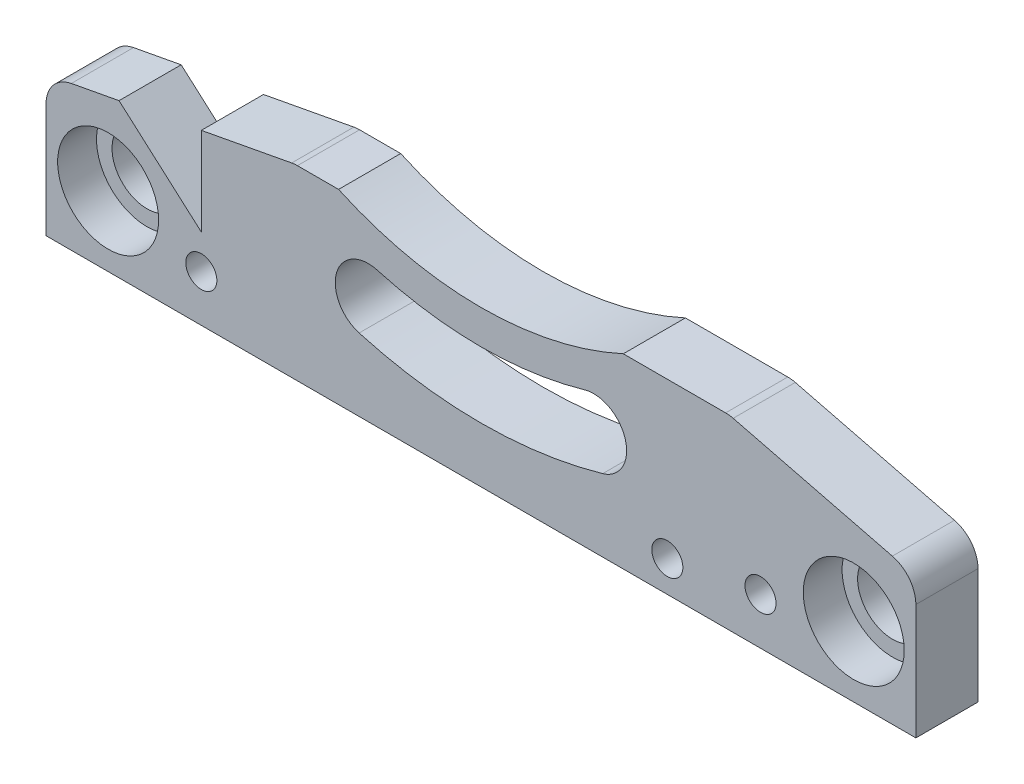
SolidWorks part; units mm, degrees
ref_plane "Front" through (0, 0, 0) normal (0, 0, 1) x (1, 0, 0)
ref_plane "Top" through (0, 0, 0) normal (0, 1, 0) x (1, 0, 0)
ref_plane "Right" through (0, 0, 0) normal (1, 0, 0) x (0, 0, -1)
sketch "Sketch1" plane through (0, 0, 0) normal (0, 0, 1) x (1, 0, 0)
  line L0 (0, 67.1585) -> (0, -46.3958) construction
  line L1 (44.45, 0) -> (-44.45, 0)
  line L2 (-44.45, 0) -> (-44.45, 19.05)
  line L3 (44.45, 0) -> (44.45, 19.05)
  line L4 (-44.45, 19.05) -> (44.45, 19.05)
  point P6 (0, 0)
  point P9 (0, 19.05)
  dimension "D1" = 88.9
  dimension "D2" = 19.05
extrude "Base-Extrude" add sketch "Sketch1" along normal blind 6.35
sketch "Sketch2" plane through (0, 0, 6.35) normal (0, 0, 1) x (1, 0, 0)
  line L0 (44.45, 14.2875) -> (25.4, 19.05)
  line L1 (44.45, 0) -> (44.45, 19.05) construction
  line L2 (-44.45, 19.05) -> (44.45, 19.05) construction
  line L3 (44.45, 0) -> (-44.45, 0) construction
  line L4 (25.4, 19.05) -> (44.45, 19.05)
  line L5 (44.45, 14.2875) -> (44.45, 19.05)
  dimension "D1" = 14.2875
  dimension "D2" = 19.05
extrude "Cut-Extrude1" cut sketch "Sketch2" against normal through all
sketch "Sketch3" plane through (0, 0, 6.35) normal (0, 0, 1) x (1, 0, 0)
  line L0 (-44.45, 19.05) -> (25.4, 19.05) construction
  line L1 (0, -50) -> (0, 50) construction
  line L2 (44.45, 0) -> (-44.45, 0) construction
  arc A0 (-14.5497, 19.05) -> (14.5497, 19.05) centre (0, 50.8) ccw
  dimension "D1" = 34.925
  dimension "D2" = 50.8
extrude "Cut-Extrude2" cut sketch "Sketch3" against normal through all
sketch "Sketch4" plane through (0, 0, 6.35) normal (0, 0, 1) x (1, 0, 0)
  line L0 (-44.45, 14.2875) -> (-19.05, 19.05)
  line L1 (-44.45, 0) -> (-44.45, 19.05) construction
  line L2 (-44.45, 19.05) -> (-14.5497, 19.05) construction
  dimension "D1" = 25.4
extrude "Cut-Extrude3" cut sketch "Sketch4" against normal through all
sketch "Sketch5" plane through (0, 0, 6.35) normal (0, 0, 1) x (1, 0, 0)
  line L0 (-36.9844, 15.6873) -> (-28.575, 8.2623)
  line L1 (-44.45, 14.2875) -> (-19.05, 19.05) construction
  line L2 (-19.05, 19.05) -> (-30.473, 6.1126) construction
  line L3 (-28.575, 8.2623) -> (-28.575, 17.2641)
  line L4 (-36.9844, 15.6873) -> (-28.575, 17.2641)
  line L5 (0, 58.217) -> (0, 5.9282) construction
  arc A0 (-14.5497, 19.05) -> (14.5497, 19.05) centre (0, 50.8) ccw construction
  point P11 (0, 50.8)
  dimension "D1" = 90
  dimension "D2" = 50.8
  dimension "D3" = 28.575
extrude "Cut-Extrude4" cut sketch "Sketch5" against normal through all
sketch "Sketch6" plane through (0, 0, 6.35) normal (0, 0, 1) x (1, 0, 0)
  line L0 (0, 50.8) -> (-14.5667, 0) construction
  line L1 (44.45, 0) -> (-44.45, 0) construction
  line L2 (0, 50.8) -> (14.5667, 0) construction
  line L3 (0, 65.7216) -> (0, 18.1985) construction
  arc A0 (-10.5871, 13.8784) -> (10.5871, 13.8784) centre (0, 50.8) ccw
  arc A1 (-14.5497, 19.05) -> (14.5497, 19.05) centre (0, 50.8) ccw construction
  arc A2 (12.4468, 7.3928) -> (-12.4468, 7.3928) centre (0, 50.8) cw
  arc A3 (11.517, 10.6356) -> (-11.517, 10.6356) centre (0, 50.8) cw construction
  arc A4 (-12.4468, 7.3928) -> (-10.5871, 13.8784) centre (-11.517, 10.6356) cw
  arc A5 (10.5871, 13.8784) -> (12.4468, 7.3928) centre (11.517, 10.6356) cw
  point P16 (0, 12.3904)
  point P17 (0, 9.017)
  point P18 (0, 5.6436)
  dimension "D2" = 41.783
  dimension "D3" = 6.7469
  dimension "D1" = 32
  dimension "D4" = 3.3734
extrude "Cut-Extrude5" cut sketch "Sketch6" against normal through all
fillet "Fillet1" radius 3.175 4 edges at (44.45, 14.2875, 3.175) (25.4, 19.05, 3.175) (-19.05, 19.05, 3.175) (-44.45, 14.2875, 3.175)
hole_wizard "Hole1" positions "Sketch8" profile "Sketch9" legacy
sketch "Sketch8" plane through (0, 0, 6.35) normal (0, 0, 1) x (1, 0, 0)
  line L0 (0, -50) -> (0, 50) construction
  line L1 (44.45, 0) -> (-44.45, 0) construction
  point P0 (38.1, 7.1438)
  dimension "D1" = 38.1
  dimension "D2" = 7.1437
sketch "Sketch9" plane through (38.1, 7.1438, 6.35) normal (1, 0, 0) x (0, -1, 0)
  line L0 (0, 0) -> (0, 6.35)
  line L1 (0, 6.35) -> (3.5719, 6.35)
  line L2 (3.5719, 6.35) -> (3.5719, 3.9688)
  line L3 (3.5719, 3.9688) -> (5.1594, 3.9688)
  line L4 (5.1594, 3.9688) -> (5.1594, 0)
  line L5 (5.1594, 0) -> (0, 0)
  line L6 (0, 110) -> (0, -10) construction
pattern_linear "LPattern1" count 2 spacing 76.2 along (-1, 0, 0) of "Hole1"
other "Hole2"
sketch "Sketch10" plane through (0, 0, 6.35) normal (0, 0, 1) x (1, 0, 0)
  line L0 (44.45, 0) -> (-44.45, 0) construction
  line L1 (0, -50) -> (0, 50) construction
  circle A0 centre (28.575, 4.7625) radius 1.5875
  dimension "D1" = 3.175
  dimension "D2" = 4.7625
  dimension "D3" = 28.575
sketch "Sketch11" plane through (-6.4225, 2.9366, 6.35) normal (0, 0, 1) x (1, 0, 0)
  line L0 (50.8725, -2.9366) -> (-38.0275, -2.9366) construction
  line L1 (6.4225, -52.9366) -> (6.4225, 47.0634) construction
  circle A0 centre (25.4725, 0.2384) radius 1.5875
  dimension "D1" = 3.175
  dimension "D2" = 3.175
  dimension "D3" = 19.05
other "Hole3"
pattern_linear "LPattern2" count 2 spacing 57.15 along (-1, 0, 0) of "Hole2"
